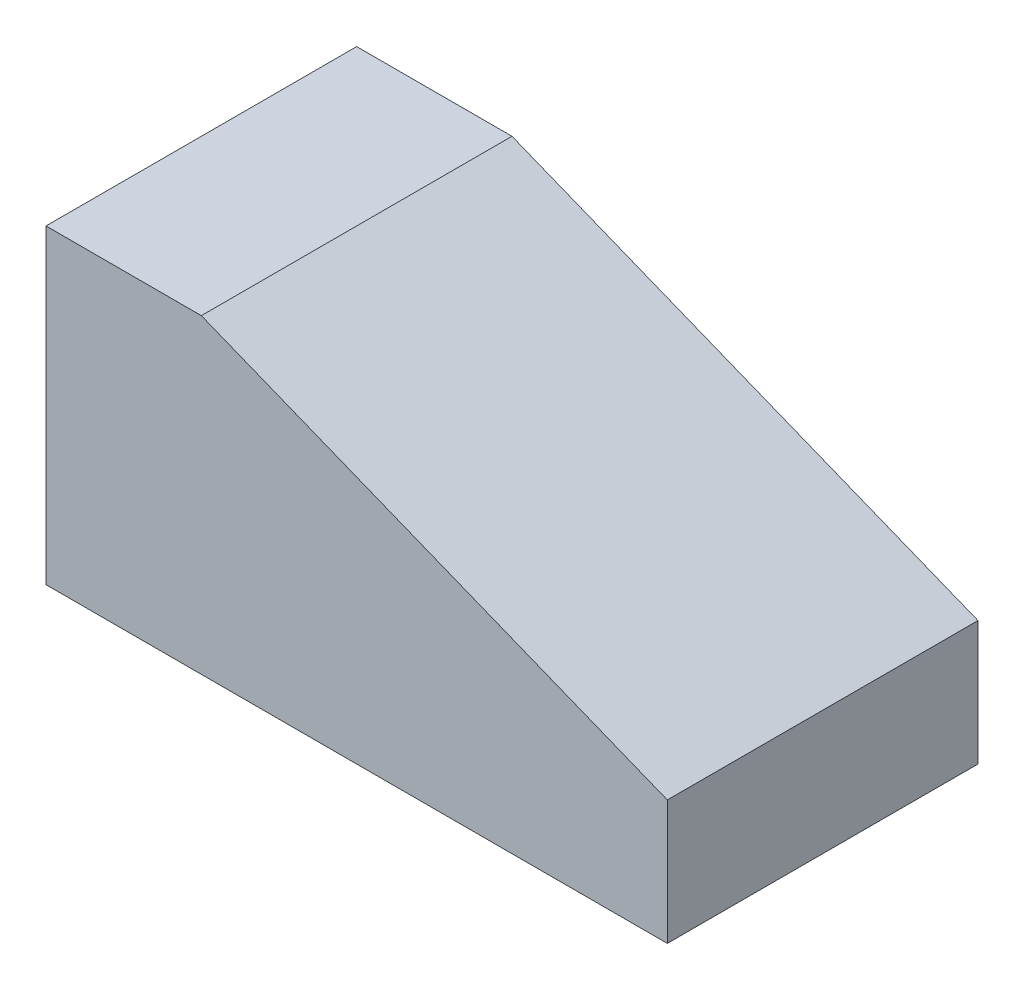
SolidWorks part; units mm, degrees
ref_plane "Front Plane" through (0, 0, 0) normal (0, 0, 1) x (1, 0, 0)
ref_plane "Top Plane" through (0, 0, 0) normal (0, 1, 0) x (1, 0, 0)
ref_plane "Right Plane" through (0, 0, 0) normal (1, 0, 0) x (0, 0, -1)
sketch "Sketch1" plane through (0, 0, 0) normal (0, 0, 1) x (1, 0, 0)
  line L0 (0, 0) -> (100, 0)
  line L1 (100, 0) -> (100, 20)
  line L2 (100, 20) -> (25, 50)
  line L3 (25, 50) -> (0, 50)
  line L4 (0, 50) -> (0, 0)
  dimension "D1" = 20
  dimension "D2" = 100
  dimension "D3" = 50
  dimension "D4" = 25
extrude "Boss-Extrude1" add sketch "Sketch1" along normal blind 50
